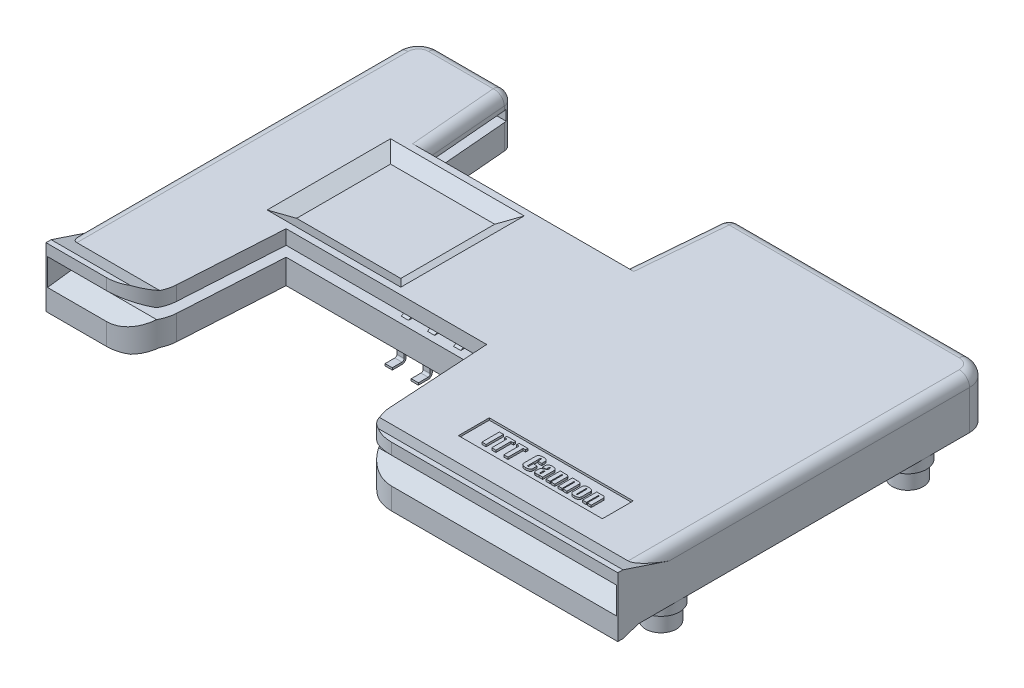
SolidWorks part; units mm, degrees
ref_plane "Front" through (0, 0, 0) normal (0, 0, 1) x (1, 0, 0)
ref_plane "Top" through (0, 0, 0) normal (0, 1, 0) x (1, 0, 0)
ref_plane "Right" through (0, 0, 0) normal (1, 0, 0) x (0, 0, -1)
sketch "Эскиз1" plane through (0, 0, 0) normal (0, 1, 0) x (1, 0, 0)
  line L0 (-1.8, -6) -> (-1.8, 30.2)
  line L1 (-1.8, 30.2) -> (7.4, 30.2)
  line L2 (7.4, 30.2) -> (8.2, 20.65)
  line L3 (8.2, 20.65) -> (27.7, 20.65)
  line L4 (27.7, 20.65) -> (28.5, 30.2)
  line L5 (28.5, 30.2) -> (53.8, 30.2)
  line L6 (53.8, 30.2) -> (53.8, -6)
  line L7 (53.8, -6) -> (28.5, -6)
  line L8 (28.5, -6) -> (27.7, 7.35)
  line L9 (27.7, 7.35) -> (8.2, 7.35)
  line L10 (8.2, 7.35) -> (7.4, -6)
  line L11 (7.4, -6) -> (-1.8, -6)
  line L12 (-1.8, 14) -> (53.8, 14) construction
  line L13 (17.95, 7.35) -> (17.95, 20.65) construction
  dimension "D1" = 1.8
  dimension "D2" = 14
  dimension "D3" = 20
  dimension "D4" = 36.2
  dimension "D5" = 55.6
  dimension "D6" = 13.3
  dimension "D7" = 19.5
  dimension "D8" = 10
  dimension "D9" = 9.2
extrude "Вытянуть1" add sketch "Эскиз1" along normal blind 6.3
sketch "Эскиз2" plane through (53.8, 0, 0) normal (1, 0, 0) x (0, 0, -1)
  line L0 (-5.5, 6.3) -> (-4, 5.8)
  line L1 (-6, 6.3) -> (30.2, 6.3) construction
  line L2 (-4, 5.8) -> (30.2, 5.8)
  line L3 (30.2, 6.3) -> (30.2, 0) construction
  line L4 (30.2, 5.8) -> (30.2, 6.3)
  line L5 (30.2, 6.3) -> (-5.5, 6.3)
  line L6 (-6, 3.4) -> (30.2, 3.4) construction
  line L7 (-6, 6.3) -> (-6, 0) construction
  line L10 (-4, 1) -> (30.2, 1)
  line L11 (-5.5, 0.5) -> (-4, 1)
  line L13 (-5.5, 0.5) -> (-6, 0.5)
  line L14 (-6, 0.5) -> (-6, 0)
  line L15 (-6, 0) -> (30.2, 0)
  line L16 (30.2, 0) -> (30.2, 1)
  dimension "D1" = 0.5
  dimension "D2" = 2
  dimension "D3" = 0.5
  dimension "D4" = 5.8
extrude "Вырез-Вытянуть1" cut sketch "Эскиз2" against normal through all
sketch "Эскиз3" plane through (0, 1, 0) normal (0, -1, 0) x (1, 0, 0)
  line L0 (-1.8, -14) -> (53.8, -14) construction
  line L1 (-1.8, -14) -> (53.8, -14) construction
  line L2 (0, 0) -> (52, 0) construction
  line L3 (0, 0) -> (0, -24) construction
  circle A0 centre (0, 0) radius 1.8
  circle A1 centre (52, 0) radius 1.8
  circle A2 centre (0, -24) radius 1.8
  circle A3 centre (52, -24) radius 1.8
  dimension "D1" = 3.6
  dimension "D2" = 52
  dimension "D3" = 24
extrude "Вытянуть2" add sketch "Эскиз3" along normal up to surface (1 mm away)
sketch "Эскиз4" plane through (0, 0, 0) normal (0, -1, 0) x (1, 0, 0)
  circle A0 centre (0, 0) radius 1.5
  circle A1 centre (0, -24) radius 1.5
  circle A2 centre (52, -24) radius 1.5
  circle A3 centre (52, 0) radius 1.5
  dimension "D1" = 3
extrude "Вытянуть3" add sketch "Эскиз4" along normal blind 1.6
sketch "Эскиз6" plane through (0, 0, 6) normal (0, 0, 1) x (1, 0, 0)
  line L0 (50.5, 0) -> (53.5, 0) construction
  line L1 (-1.15, 4.4) -> (53.15, 4.4)
  line L2 (-1.15, 4.4) -> (-1.15, 3.4)
  line L3 (-1.15, 3.4) -> (53.15, 3.4)
  line L4 (53.15, 4.4) -> (53.15, 3.4)
  line L5 (0, 0) -> (52, 0) construction
  line L6 (26, 0) -> (26, 6.9612) construction
  dimension "D1" = 1
  dimension "D2" = 4.4
  dimension "D3" = 54.3
extrude "Вырез-Вытянуть2" cut sketch "Эскиз6" against normal blind 35.5
ref_plane "Плоскость1" through (19.12, 0, 0) normal (1, 0, 0) x (0, 0, -1)
sketch "Эскиз10" plane through (19.12, 0, 0) normal (1, 0, 0) x (0, 0, -1)
  line L0 (21.6, 0) -> (20.65, 0)
  line L1 (20.25, 0.4) -> (20.25, 2.8)
  line L2 (20.0587, 3.1412) -> (19.2217, 3.6531)
  line L3 (18.4313, 3.7632) -> (15.4687, 2.9368)
  line L4 (15.2, 2.9) -> (14, 2.9)
  line L5 (14, 2.9) -> (14, 0) construction
  line L6 (21.6, 0.2) -> (20.65, 0.2)
  line L7 (20.45, 0.4) -> (20.45, 2.8)
  line L8 (20.163, 3.3119) -> (19.3261, 3.8237)
  line L9 (18.3776, 3.9559) -> (15.415, 3.1294)
  line L10 (15.2, 3.1) -> (14, 3.1)
  line L11 (21.6, 0) -> (21.6, 0.2)
  line L12 (6.4, 0) -> (6.4, 0.2)
  line L13 (12.8, 3.1) -> (14, 3.1)
  line L14 (9.6224, 3.9559) -> (12.585, 3.1294)
  line L15 (7.837, 3.3119) -> (8.6739, 3.8237)
  line L16 (7.55, 0.4) -> (7.55, 2.8)
  line L17 (6.4, 0.2) -> (7.35, 0.2)
  line L18 (12.8, 2.9) -> (14, 2.9)
  line L19 (9.5687, 3.7632) -> (12.5313, 2.9368)
  line L20 (7.9413, 3.1412) -> (8.7783, 3.6531)
  line L21 (7.75, 0.4) -> (7.75, 2.8)
  line L22 (6.4, 0) -> (7.35, 0)
  line L25 (-6, 6.3) -> (-6, 0.5) construction
  line L26 (29.5, 3.4) -> (-6, 3.4) construction
  arc A0 (20.65, 0) -> (20.25, 0.4) centre (20.65, 0.4) cw
  arc A1 (20.25, 2.8) -> (20.0587, 3.1412) centre (19.85, 2.8) ccw
  arc A2 (19.2217, 3.6531) -> (18.4313, 3.7632) centre (18.7, 2.8) ccw
  arc A3 (15.4687, 2.9368) -> (15.2, 2.9) centre (15.2, 3.9) cw
  arc A4 (20.65, 0.2) -> (20.45, 0.4) centre (20.65, 0.4) cw
  arc A5 (20.45, 2.8) -> (20.163, 3.3119) centre (19.85, 2.8) ccw
  arc A6 (19.3261, 3.8237) -> (18.3776, 3.9559) centre (18.7, 2.8) ccw
  arc A7 (15.415, 3.1294) -> (15.2, 3.1) centre (15.2, 3.9) cw
  arc A8 (12.585, 3.1294) -> (12.8, 3.1) centre (12.8, 3.9) ccw
  arc A9 (8.6739, 3.8237) -> (9.6224, 3.9559) centre (9.3, 2.8) cw
  arc A10 (7.55, 2.8) -> (7.837, 3.3119) centre (8.15, 2.8) cw
  arc A11 (7.35, 0.2) -> (7.55, 0.4) centre (7.35, 0.4) ccw
  arc A12 (12.5313, 2.9368) -> (12.8, 2.9) centre (12.8, 3.9) ccw
  arc A13 (8.7783, 3.6531) -> (9.5687, 3.7632) centre (9.3, 2.8) cw
  arc A14 (7.75, 2.8) -> (7.9413, 3.1412) centre (8.15, 2.8) cw
  arc A15 (7.35, 0) -> (7.75, 0.4) centre (7.35, 0.4) ccw
  arc A16 (20.25, 2.8) -> (20.0587, 3.1412) centre (19.85, 2.8) ccw construction
  arc A17 (19.2217, 3.6531) -> (18.4313, 3.7632) centre (18.7, 2.8) ccw construction
  arc A18 (15.4687, 2.9368) -> (15.2, 2.9) centre (15.2, 3.9) cw construction
  dimension "D1" = 0.4
  dimension "D2" = 1
  dimension "D3" = 1
  dimension "D4" = 0.2
  dimension "D5" = 20
  dimension "D6" = 15.2
  dimension "D7" = 12.5
  dimension "D8" = 4.7
  dimension "D9" = 2.8
  dimension "D10" = 0.5
  dimension "D11" = 1.2
extrude "Вытянуть7" add sketch "Эскиз10" along normal mid plane 0.7
pattern_linear "Линейный массив1" count 6 spacing 2.54 along (1, 0, 0) count 2 spacing 9.2 along (0.0835, 0, -0.9965) of "Вытянуть7"
other "Удалить грань1"
sketch "Эскиз7" plane through (0, 5.8, 0) normal (0, 1, 0) x (-1, 0, 0)
  line L0 (1.8, -14) -> (-53.8, -14) construction
  line L1 (-5.7, -8) -> (-18.7, -8)
  line L2 (-5.7, -8) -> (-5.7, -20)
  line L3 (-5.7, -20) -> (-18.7, -20)
  line L4 (-18.7, -8) -> (-18.7, -20)
  line L5 (1.8, -14) -> (-53.8, -14) construction
  line L6 (1.8, 4) -> (1.8, -30.2) construction
  dimension "D1" = 12
  dimension "D2" = 13
  dimension "D3" = 7.5
extrude "Вырез-Вытянуть3" cut sketch "Эскиз7" against normal blind 0.7 draft 64
sketch "Эскиз8" plane through (0, 5.8, 0) normal (0, 1, 0) x (-1, 0, 0)
  line L0 (-53.8, 4) -> (-53.8, -30.2) construction
  line L1 (-34, -1.3) -> (-48, -1.3)
  line L2 (-34, -1.3) -> (-34, 1.7)
  line L3 (-34, 1.7) -> (-48, 1.7)
  line L4 (-48, -1.3) -> (-48, 1.7)
  line L5 (-28.5, 6) -> (-53.8, 6) construction
  dimension "D1" = 3
  dimension "D2" = 14
  dimension "D3" = 5.8
  dimension "D4" = 4.3
extrude "Вырез-Вытянуть4" cut sketch "Эскиз8" against normal blind 0.2
sketch "Эскиз9"
  dimension "D1" = 0.6
extrude "Вытянуть5" add sketch "Эскиз9" along normal blind 0.2
chamfer "Фаска1" distance 0.8 distance2 1.8 4 edges at (3.125, 3.4, 6) (40.825, 3.4, 6) (3.125, 4.4, 6) (40.825, 4.4, 6)
chamfer "Фаска2" distance 0.5 angle 74.5 2 edges at (53.15, 3.9, 6) (-1.15, 3.9, 6)
fillet "Скругление1" radius 3.5 4 edges at (28.5, 1.55, 6) (28.5, 5.75, 6) (7.4, 1.55, 6) (7.4, 5.75, 6)
fillet "Скругление2" radius 1 2 edges at (28.5, 3.4, -30.2) (7.4, 3.4, -30.2)
fillet "Скругление3" radius 2 2 edges at (53.8, 3.4, -30.2) (-1.8, 3.4, -30.2)
fillet "Скругление4" radius 1 10 edges at (28.0616, 5.8, -24.9667) (28.7428, 5.8, -29.936) (40.6099, 5.8, -30.2) (53.2142, 5.8, -29.6142) (7.8384, 5.8, -24.9667) (7.1572, 5.8, -29.936) (3.3401, 5.8, -30.2) (-1.2142, 5.8, -29.6142) (53.8, 5.8, -12.1) (-1.8, 5.8, -12.1)
